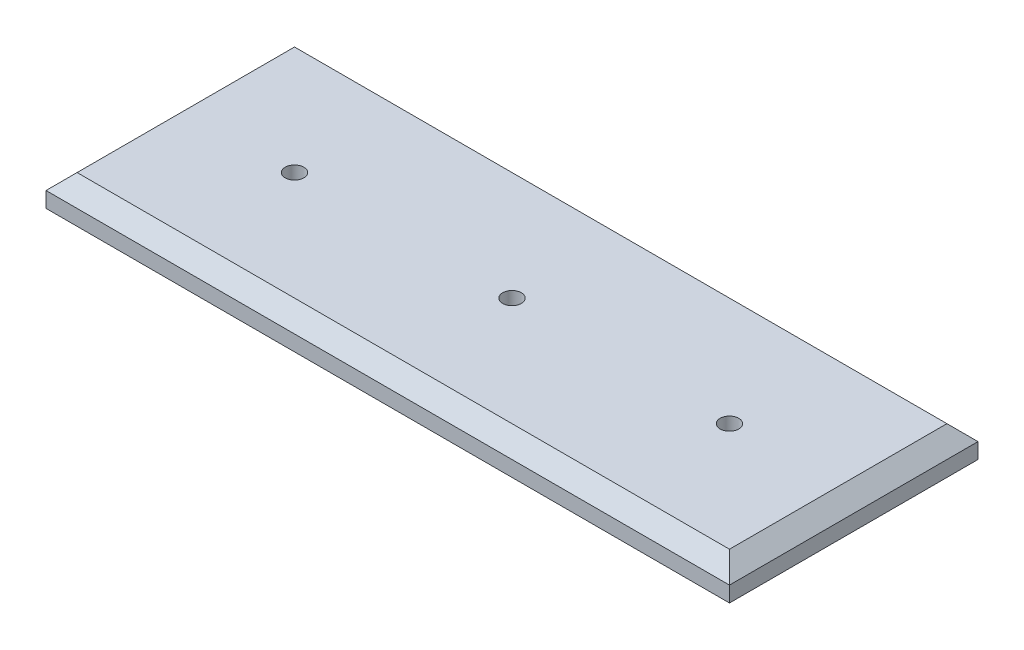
SolidWorks part; units mm, degrees
ref_plane "Front Plane" through (0, 0, 0) normal (0, 0, 1) x (1, 0, 0)
ref_plane "Top Plane" through (0, 0, 0) normal (0, 1, 0) x (1, 0, 0)
ref_plane "Right Plane" through (0, 0, 0) normal (1, 0, 0) x (0, 0, -1)
sketch "Sketch1" plane through (0, 0, 0) normal (0, 1, 0) x (1, 0, 0)
  line L1 (0, 0) -> (220, 0)
  line L2 (0, 0) -> (0, 80)
  line L3 (0, 80) -> (220, 80)
  line L4 (220, 0) -> (220, 80)
  dimension "D1" = 80
  dimension "D2" = 220
extrude "Extrude1" add sketch "Sketch1" along normal blind 10
sketch "Sketch2" plane through (0, 0, 0) normal (0, -1, 0) x (1, 0, 0)
  line L0 (220, 0) -> (220, -80) construction
  line L1 (5, -5) -> (215, -5)
  line L2 (5, -5) -> (5, -75)
  line L3 (5, -75) -> (215, -75)
  line L4 (215, -5) -> (215, -75)
  line L5 (0, 0) -> (220, 0) construction
  line L6 (220, -80) -> (0, -80) construction
  line L7 (0, -80) -> (0, 0) construction
  dimension "D1" = 5
  dimension "D2" = 5
  dimension "D3" = 5
  dimension "D4" = 5
extrude "Extrude2" cut sketch "Sketch2" against normal blind 5
sketch "Sketch3" plane through (0, 10, 0) normal (0, 1, 0) x (1, 0, 0)
  line L0 (0, 40) -> (220, 40) construction
  line L3 (0, 80) -> (0, 0) construction
  line L4 (220, 0) -> (220, 80) construction
  circle A0 centre (110, 40) radius 3
  circle A1 centre (40, 40) radius 3
  circle A2 centre (180, 40) radius 3
  dimension "D1" = 6
  dimension "D2" = 70
  dimension "D3" = 70
extrude "Extrude3" cut sketch "Sketch3" against normal blind 5
chamfer "Chamfer1" distance 5 angle 45 4 edges at (0, 10, -40) (110, 10, -80) (220, 10, -40) (110, 10, 0)
